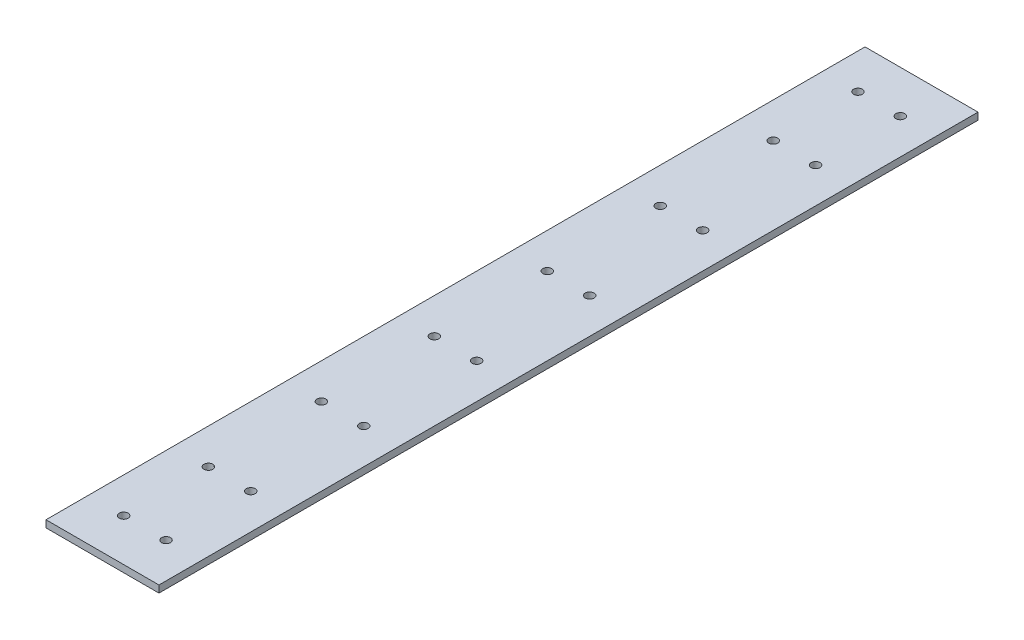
SolidWorks part; units mm, degrees
ref_plane "Front Plane" through (0, 0, 0) normal (0, 0, 1) x (1, 0, 0)
ref_plane "Top Plane" through (0, 0, 0) normal (0, 1, 0) x (1, 0, 0)
ref_plane "Right Plane" through (0, 0, 0) normal (1, 0, 0) x (0, 0, -1)
sketch "Sketch1" plane through (0, 0, 0) normal (0, 0, 1) x (1, 0, 0)
  line L1 (50.8, -3.175) -> (-50.8, -3.175)
  line L2 (50.8, -3.175) -> (50.8, 3.175)
  line L3 (50.8, 3.175) -> (-50.8, 3.175)
  line L4 (-50.8, -3.175) -> (-50.8, 3.175)
  line L5 (50.8, -3.175) -> (-50.8, 3.175) construction
  line L6 (50.8, 3.175) -> (-50.8, -3.175) construction
  point P0 (0, 0)
  dimension "D1" = 6.35
  dimension "D2" = 101.6
extrude "Extrude1" add sketch "Sketch1" along normal blind 736.6
sketch "Sketch2" plane through (0, 3.175, 0) normal (0, 1, 0) x (1, 0, 0)
  line L0 (-50.8, -736.6) -> (-50.8, 0) construction
  line L1 (50.8, 0) -> (-50.8, 0) construction
  circle A0 centre (-19.05, -38.1) radius 3.9751
  circle A1 centre (19.05, -38.1) radius 3.9751
  circle A2 centre (19.05, -114.3) radius 3.9751
  circle A3 centre (19.05, -215.9) radius 3.9751
  circle A4 centre (19.05, -317.5) radius 3.9751
  circle A5 centre (19.05, -419.1) radius 3.9751
  circle A6 centre (19.05, -520.7) radius 3.9751
  circle A7 centre (19.05, -622.3) radius 3.9751
  circle A8 centre (19.05, -698.5) radius 3.9751
  circle A11 centre (-19.05, -698.5) radius 3.9751
  circle A12 centre (-19.05, -622.3) radius 3.9751
  circle A13 centre (-19.05, -520.7) radius 3.9751
  circle A14 centre (-19.05, -419.1) radius 3.9751
  circle A15 centre (-19.05, -317.5) radius 3.9751
  circle A16 centre (-19.05, -215.9) radius 3.9751
  circle A17 centre (-19.05, -114.3) radius 3.9751
  dimension "D2" = 7.9502
  dimension "D3" = 7.9502
  dimension "D7" = 7.9502
  dimension "D8" = 7.9502
  dimension "D13" = 7.9502
  dimension "D14" = 7.9502
  dimension "D15" = 7.9502
  dimension "D16" = 7.9502
  dimension "D21" = 7.9502
  dimension "D22" = 7.9502
  dimension "D31" = 7.9502
  dimension "D32" = 7.9502
  dimension "D37" = 7.9502
  dimension "D38" = 7.9502
  dimension "D43" = 7.9502
  dimension "D44" = 7.9502
  dimension "D1" = 31.75
  dimension "D4" = 38.1
  dimension "D5" = 38.1
  dimension "D6" = 38.1
  dimension "D9" = 31.75
  dimension "D10" = 38.1
  dimension "D11" = 76.2
  dimension "D12" = 76.2
  dimension "D17" = 31.75
  dimension "D18" = 38.1
  dimension "D19" = 101.6
  dimension "D20" = 101.6
  dimension "D23" = 31.75
  dimension "D24" = 38.1
  dimension "D25" = 101.6
  dimension "D26" = 101.6
  dimension "D27" = 31.75
  dimension "D28" = 101.6
  dimension "D29" = 101.6
  dimension "D30" = 38.1
  dimension "D33" = 31.75
  dimension "D34" = 38.1
  dimension "D35" = 101.6
  dimension "D36" = 101.6
  dimension "D39" = 31.75
  dimension "D40" = 101.6
  dimension "D41" = 101.6
  dimension "D42" = 38.1
  dimension "D45" = 31.75
  dimension "D46" = 76.2
  dimension "D47" = 76.2
  dimension "D48" = 38.1
extrude "Extrude2" cut sketch "Sketch2" against normal blind 6.35
